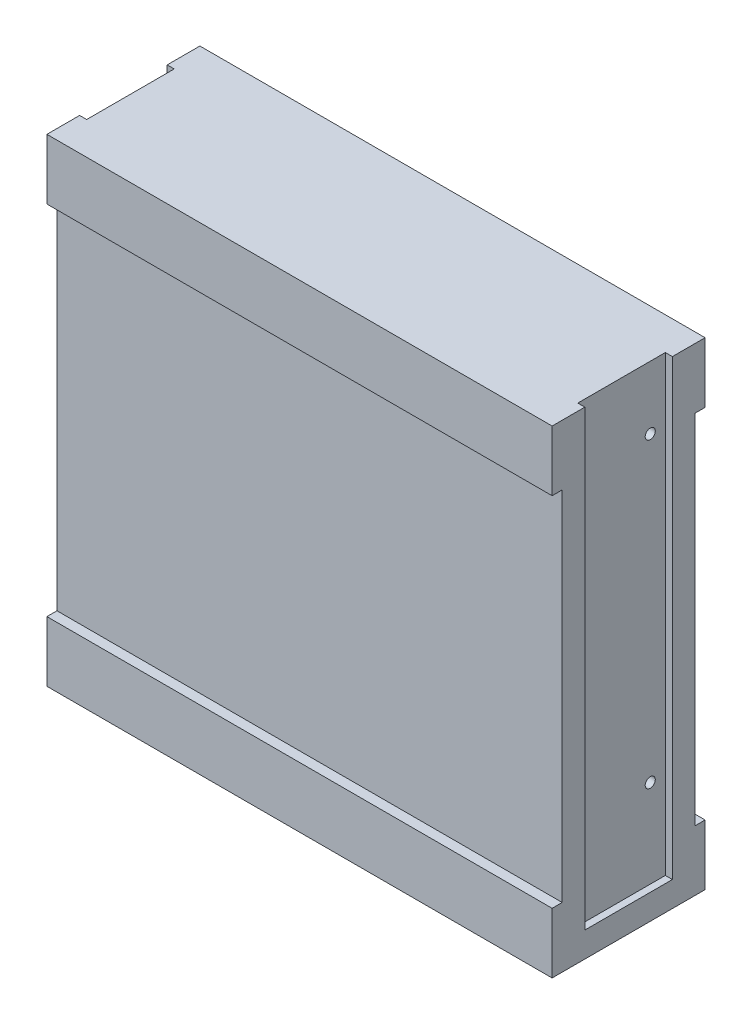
SolidWorks part; units mm, degrees
ref_plane "Front Plane" through (0, 0, 0) normal (0, 0, 1) x (1, 0, 0)
ref_plane "Top Plane" through (0, 0, 0) normal (0, 1, 0) x (1, 0, 0)
ref_plane "Right Plane" through (0, 0, 0) normal (1, 0, 0) x (0, 0, -1)
sketch "Sketch1" plane through (0, 0, 0) normal (0, 0, 1) x (1, 0, 0)
  line L1 (-136.4512, 43.1006) -> (-36.0512, 43.1006)
  line L2 (-136.4512, 43.1006) -> (-136.4512, -51.8994)
  line L3 (-136.4512, -51.8994) -> (-36.0512, -51.8994)
  line L4 (-36.0512, 43.1006) -> (-36.0512, -51.8994)
  dimension "D1" = 100.4
  dimension "D2" = 95
extrude "Boss-Extrude1" add sketch "Sketch1" along normal blind 30.4
ref_plane "Plane1" through (-36.0512, 0, 0) normal (1, 0, 0) x (0, 0, -1)
sketch "Sketch2" plane through (-36.0512, 0, 0) normal (1, 0, 0) x (0, 0, -1)
  line L0 (-30.4, -51.8994) -> (0, -51.8994) construction
  line L2 (0, -51.8994) -> (0, 43.1006) construction
  circle A0 centre (-9.5, -29.3994) radius 1
  circle A1 centre (-9.5, 30.6006) radius 1
  dimension "D1" = 2
  dimension "D3" = 60
  dimension "D4" = 2
  dimension "D2" = 22.5
  dimension "D5" = 9.5
  dimension "D6" = 9.5
extrude "Cut-Extrude1" cut sketch "Sketch2" against normal up to surface (100.4 mm away)
ref_plane "Plane2" through (-136.4512, 0, 0) normal (-1, 0, 0) x (0, 0, 1)
sketch "Sketch5" plane through (-36.0512, 0, 0) normal (1, 0, 0) x (0, 0, -1)
  line L0 (-30.4, -51.8994) -> (-30.4, 43.1006) construction
  line L1 (-30.4, -39.8994) -> (-28.4, -39.8994)
  line L2 (-30.4, -39.8994) -> (-30.4, 31.1006)
  line L3 (-30.4, 31.1006) -> (-28.4, 31.1006)
  line L4 (-28.4, -39.8994) -> (-28.4, 31.1006)
  line L5 (0, -51.8994) -> (0, 43.1006) construction
  line L6 (0, -39.8994) -> (-2, -39.8994)
  line L7 (0, -39.8994) -> (0, 31.1006)
  line L8 (0, 31.1006) -> (-2, 31.1006)
  line L9 (-2, -39.8994) -> (-2, 31.1006)
  line L10 (-30.4, -51.8994) -> (0, -51.8994) construction
  line L11 (-30.4, 43.1006) -> (0, 43.1006) construction
  point P14 (-29.4, -39.8994)
  point P17 (-1, 31.1006)
  dimension "D1" = 2
  dimension "D2" = 12
  dimension "D3" = 2
  dimension "D4" = 12
  dimension "D5" = 12
  dimension "D6" = 12
extrude "Cut-Extrude4" cut sketch "Sketch5" against normal up to surface (100.4 mm away)
sketch "Sketch4" plane through (-136.4512, 0, 0) normal (-1, 0, 0) x (0, 0, 1)
  line L0 (30.4, 43.1006) -> (0, 43.1006) construction
  line L1 (23.9, 43.1006) -> (6.5, 43.1006)
  line L2 (23.9, 43.1006) -> (23.9, -46.8994)
  line L3 (23.9, -46.8994) -> (6.5, -46.8994)
  line L4 (6.5, 43.1006) -> (6.5, -46.8994)
  line L6 (30.4, -51.8994) -> (0, -51.8994) construction
  line L10 (28.4, -39.8994) -> (28.4, 31.1006) construction
  line L11 (2, 31.1006) -> (2, -39.8994) construction
  dimension "D1" = 4.5
  dimension "D2" = 5
  dimension "D3" = 4.5
sketch "Sketch3" plane through (-36.0512, 0, 0) normal (1, 0, 0) x (0, 0, -1)
  line L0 (-30.4, 43.1006) -> (0, 43.1006) construction
  line L1 (-23.9, -46.8994) -> (-6.5, -46.8994)
  line L2 (-23.9, -46.8994) -> (-23.9, 43.1006)
  line L3 (-23.9, 43.1006) -> (-6.5, 43.1006)
  line L4 (-6.5, -46.8994) -> (-6.5, 43.1006)
extrude "Cut-Extrude5" cut sketch "Sketch4" against normal blind 1.4
extrude "Cut-Extrude6" cut sketch "Sketch3" against normal blind 1.4
